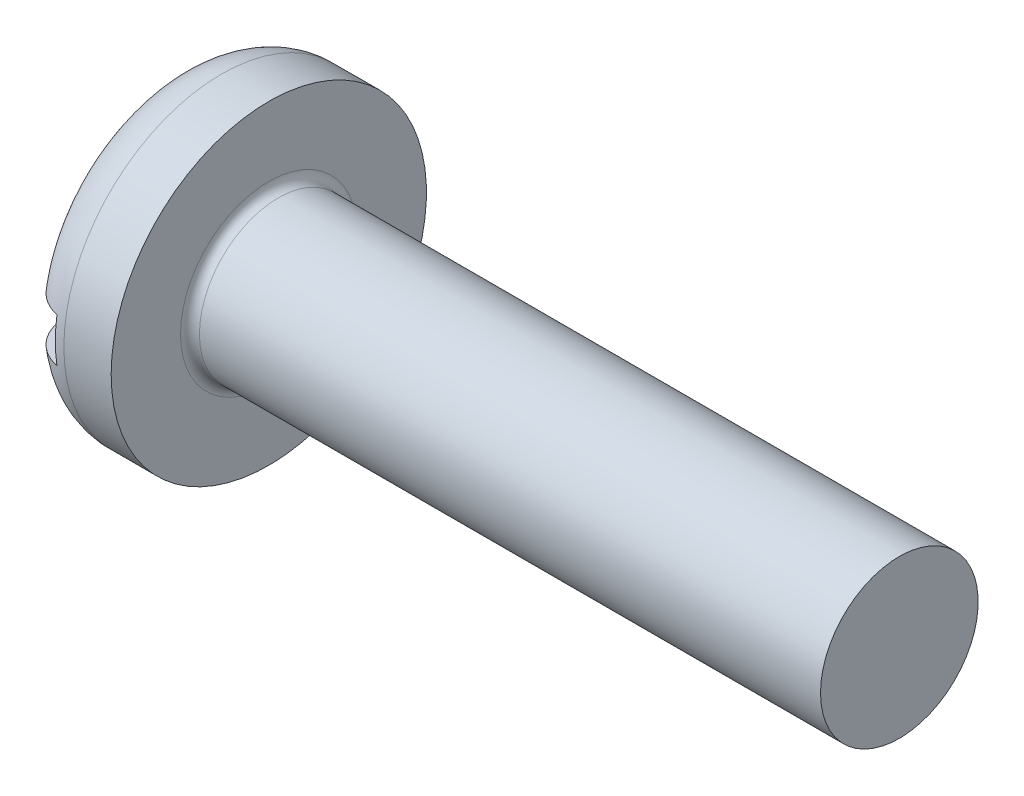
SolidWorks part; units mm, degrees
ref_plane "Front Plane" through (0, 0, 0) normal (0, 0, 1) x (1, 0, 0)
ref_plane "Top Plane" through (0, 0, 0) normal (0, 1, 0) x (1, 0, 0)
ref_plane "Right Plane" through (0, 0, 0) normal (1, 0, 0) x (0, 0, -1)
other "Configuration Table"
sketch "BodySke" plane through (0, 0, 0) normal (0, 0, 1) x (1, 0, 0)
  line L0 (0, 0) -> (111.3824, 0) construction
  line L1 (0, 0) -> (0, 10)
  line L2 (0, 10) -> (6, 10)
  line L3 (6, 10) -> (6, 5)
  line L4 (6, 5) -> (46, 5)
  line L5 (46, 5) -> (46, 0)
  line L6 (7.5, 8.824) -> (7.5, -5.8939) construction
  line L7 (0, 0) -> (46, 0)
  line L8 (9, 8.824) -> (9, -5.8939) construction
  point P10 (46, 4.172)
revolve "BaseBody" add sketch "BodySke" angle 360 about L0
fillet "Fillet_head" radius 3 1 edges at (0, 0, 10)
fillet "Fillet2" radius 0.6 1 edges at (6, 0, 5)
sketch "SlotSke" plane through (0, 0, 0) normal (-1, 0, 0) x (0, 0, 1)
  line L1 (-10, 1.405) -> (10, 1.405)
  line L2 (-10, 1.405) -> (-10, -1.405)
  line L3 (-10, -1.405) -> (10, -1.405)
  line L4 (10, 1.405) -> (10, -1.405)
extrude "Slot" cut sketch "SlotSke" against normal blind 2.4
sketch "ThdSchSke" plane through (0, 0, 0) normal (0, 0, 1) x (1, 0, 0)
  line L0 (0, 0) -> (55.1256, 0) construction
  line L1 (0, 0) -> (111.3824, 0) construction
  line L2 (45.522, 5) -> (45.522, 5.9561)
  line L3 (45.522, 5.9561) -> (46.478, 5.9561)
  line L4 (46.478, 5.9561) -> (46.478, 5)
  line L5 (46.478, 5) -> (46, 4.172)
  line L6 (46, 4.172) -> (45.522, 5)
  line L7 (6, 5) -> (46, 5) construction
  line L13 (46, 5) -> (46, 0) construction
revolve "ThreadSchematic" [suppressed] cut sketch "ThdSchSke" angle 360 about L0
pattern_linear "ThdSchPat" [suppressed] count 25 along (1, 0, 0)
equation "\"Thread_minor@ThreadCosmetic\" = \"Thread_minor@BodySke\""
equation "\"D1@SlotSke\" = \"Head_dia@BodySke\""
equation "\"D2@SlotSke\" = \"D1@SlotSke\" / 2"
equation "\"D3@SlotSke\" = \"Slot_width@SlotSke\" / 2"
equation "\"Advance@ThdSchPat\" = \"Advance@BodySke\""
equation "\"D1@ThdSchPat\" =  int(  ( \"Length@BodySke\"-\"Thread_runout@BodySke\" )  /\"Advance@ThdSchPat\" )  + 1"
